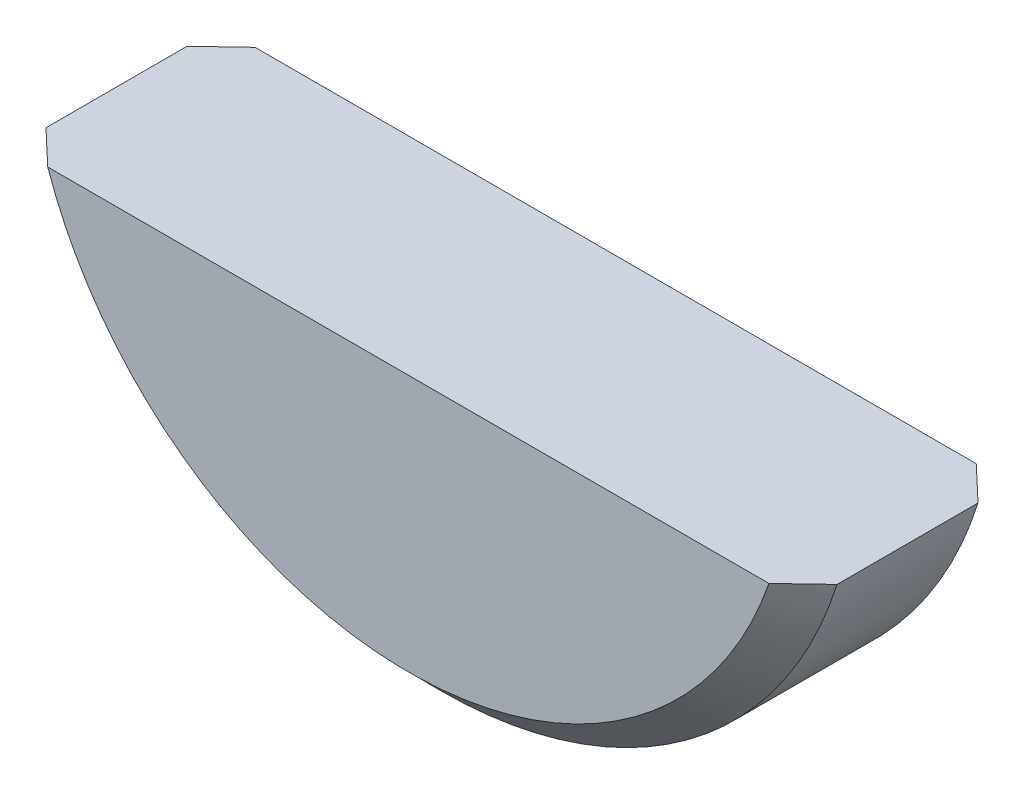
SolidWorks part; units mm, degrees
ref_plane "Front Plane" through (0, 0, 0) normal (0, 0, 1) x (1, 0, 0)
ref_plane "Top Plane" through (0, 0, 0) normal (0, 1, 0) x (1, 0, 0)
ref_plane "Right Plane" through (0, 0, 0) normal (1, 0, 0) x (0, 0, -1)
other "Configuration Table"
sketch "BodySke" plane through (0, 0, 0) normal (0, 0, 1) x (1, 0, 0)
  line L0 (0, 0) -> (0, 8.1206) construction
  line L1 (-1.9079, 1.4) -> (1.9079, 1.4)
  line L2 (-1.0536, 0.3) -> (1.0536, 0.3) construction
  arc A0 (-1.9079, 1.4) -> (1.9079, 1.4) centre (0, 2) ccw
  dimension "Key_Diameter" = 4
  dimension "Height_normal" = 1.4
  dimension "Height_whitney" = 1.1
extrude "BaseBody" add sketch "BodySke" along normal blind 1
chamfer "Chamfer" distance 0.16 angle 45 2 edges at (0, 0, 0) (0, 0, 1)
sketch "WhitneySke" plane through (0, 0, 0) normal (0, 0, 1) x (1, 0, 0)
  line L0 (0, 0) -> (0, 1.9557) construction
  line L1 (0, 0) -> (0, 8.1206) construction
  line L2 (-1.0536, 0.3) -> (1.0536, 0.3) construction
  line L3 (-1.0536, 0.3) -> (1.0536, 0.3)
  arc A0 (-1.9079, 1.4) -> (1.9079, 1.4) centre (0, 2) ccw construction
  arc A1 (-1.0536, 0.3) -> (1.0536, 0.3) centre (0, 2) ccw
extrude "Whitney" [suppressed] cut sketch "WhitneySke" along normal through all
